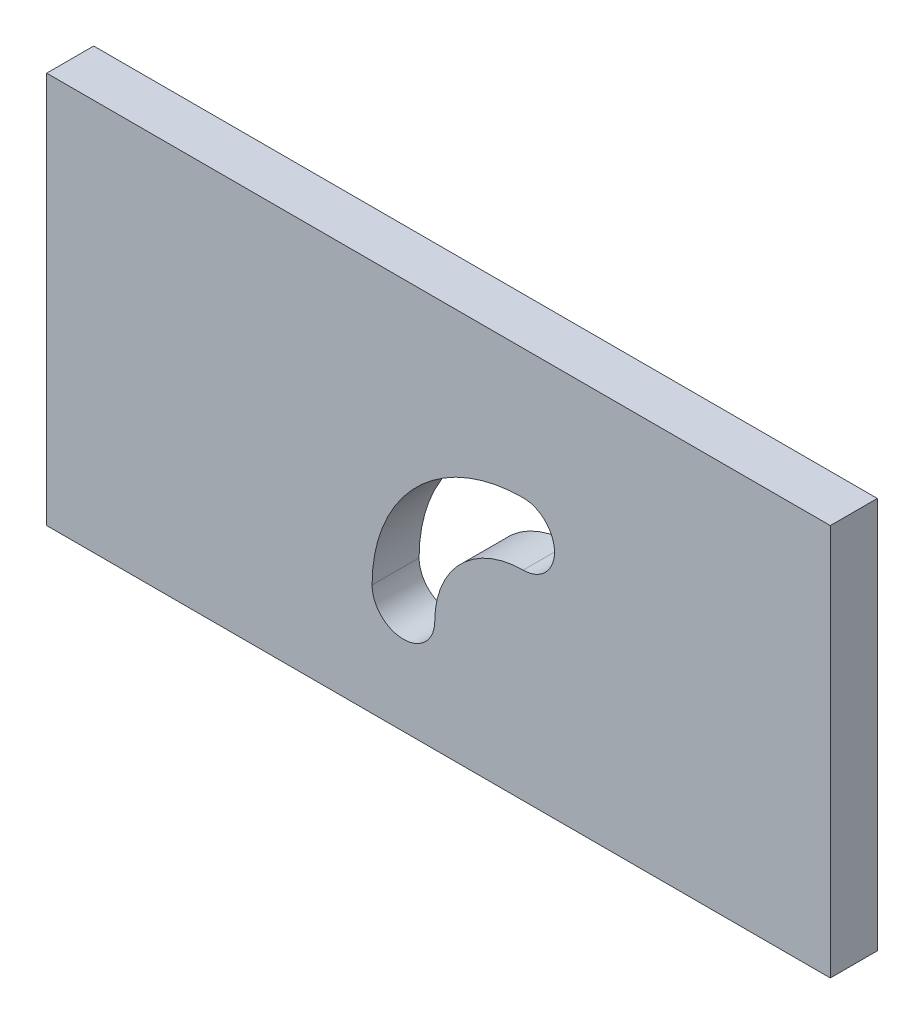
SolidWorks part; units mm, degrees
ref_plane "Front" through (0, 0, 0) normal (0, 0, 1) x (1, 0, 0)
ref_plane "Top" through (0, 0, 0) normal (0, 1, 0) x (1, 0, 0)
ref_plane "Right" through (0, 0, 0) normal (1, 0, 0) x (0, 0, -1)
sketch "Sketch1" plane through (0, 0, 0) normal (0, 0, 1) x (1, 0, 0)
  line L0 (0, 0) -> (50, 0)
  line L1 (50, 0) -> (50, 25)
  line L2 (50, 25) -> (0, 25)
  line L3 (0, 25) -> (0, 0)
  line L4 (22.7625, 7.0981) -> (30.4019, 14.7375) construction
  line L5 (0, 12.5) -> (50, 12.5) construction
  line L6 (26.5822, 10.9178) -> (25, 12.5) construction
  arc A0 (22.7625, 7.0981) -> (30.4019, 14.7375) centre (30.4019, 7.0981) cw construction
  arc A1 (24.7625, 7.0981) -> (30.4019, 12.7375) centre (30.4019, 7.0981) cw
  arc A2 (20.7625, 7.0981) -> (30.4019, 16.7375) centre (30.4019, 7.0981) cw
  arc A3 (24.7625, 7.0981) -> (20.7625, 7.0981) centre (22.7625, 7.0981) cw
  arc A4 (30.4019, 12.7375) -> (30.4019, 16.7375) centre (30.4019, 14.7375) ccw
  dimension "D1" = 50
  dimension "D2" = 25
  dimension "D5" = 12
  dimension "D3" = 2
  dimension "D4" = 2
extrude "Extrude1" add sketch "Sketch1" along normal blind 3
sketch "Sketch2" plane through (0, 0, 3) normal (0, 0, 1) x (1, 0, 0)
  circle A0 centre (30.4019, 7.0981) radius 5.6394
  arc A3 (30.4019, 12.7375) -> (24.7625, 7.0981) centre (30.4019, 7.0981) ccw construction
